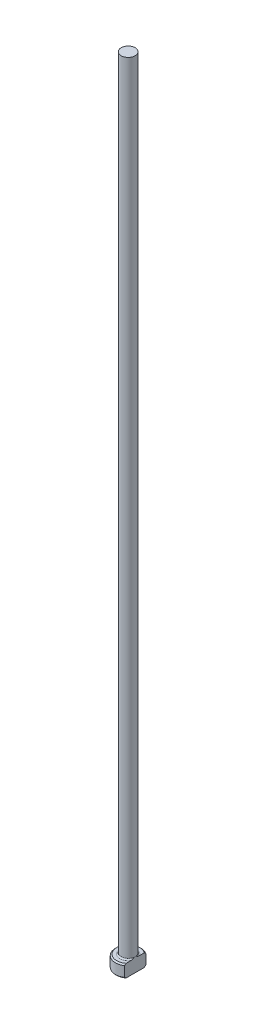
SolidWorks part; units mm, degrees
ref_plane "Front Plane" through (0, 0, 0) normal (0, 0, 1) x (1, 0, 0)
ref_plane "Top Plane" through (0, 0, 0) normal (0, 1, 0) x (1, 0, 0)
ref_plane "Right Plane" through (0, 0, 0) normal (1, 0, 0) x (0, 0, -1)
sketch "Sketch1" plane through (0, 0, 0) normal (0, 0, 1) x (1, 0, 0)
  line L0 (0, 259.9588) -> (0, -15.1925) construction
  line L1 (0, 0) -> (-2, 0)
  line L2 (-2, 0) -> (-2, 2)
  line L3 (-2, 2) -> (-1.1, 2)
  line L4 (-1.1, 2) -> (-1.1, 125)
  line L5 (-1.1, 125) -> (0, 125)
  line L6 (0, 125) -> (0, 0)
  dimension "L" = 125
  dimension "H" = 4
  dimension "T" = 2
  dimension "D" = 2.2
revolve "Revolve1" add sketch "Sketch1" angle 360 about L0
chamfer "Chamfer1" distance 0.2 angle 45 2 edges at (0, 2, 2) (0, 0, 2)
fillet "Fillet1" radius 0.2 1 edges at (0, 2, 1.1)
sketch "Sketch2" plane through (0, 0, 0) normal (0, 1, 0) x (1, 0, 0)
  line L0 (1.1, 1.6703) -> (1.1, -1.6703)
  circle A0 centre (0, 0) radius 2 construction
  arc A1 (1.1, -1.6703) -> (1.1, 1.6703) centre (0, 0) ccw
  circle A2 centre (0, 0) radius 1.1 construction
extrude "KEY" cut sketch "Sketch2" along normal through all
